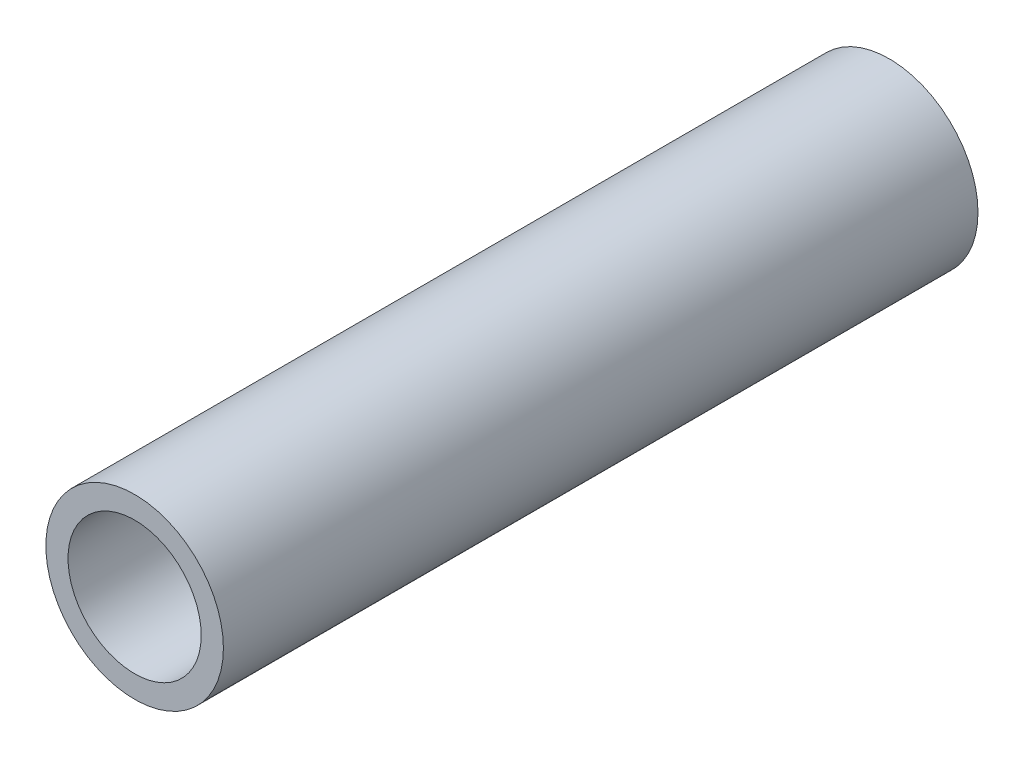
SolidWorks part; units mm, degrees
ref_plane "Face" through (0, 0, 0) normal (0, 0, 1) x (1, 0, 0)
ref_plane "Dessus" through (0, 0, 0) normal (0, 1, 0) x (1, 0, 0)
ref_plane "Droite" through (0, 0, 0) normal (1, 0, 0) x (0, 0, -1)
sketch "Esquisse1" plane through (0, 0, 0) normal (0, 0, 1) x (1, 0, 0)
  circle A0 centre (0, 0) radius 3
  circle A1 centre (0, 0) radius 4
  dimension "D1" = 6
  dimension "D2" = 1
extrude "Extrusion1" add sketch "Esquisse1" along normal blind 34
